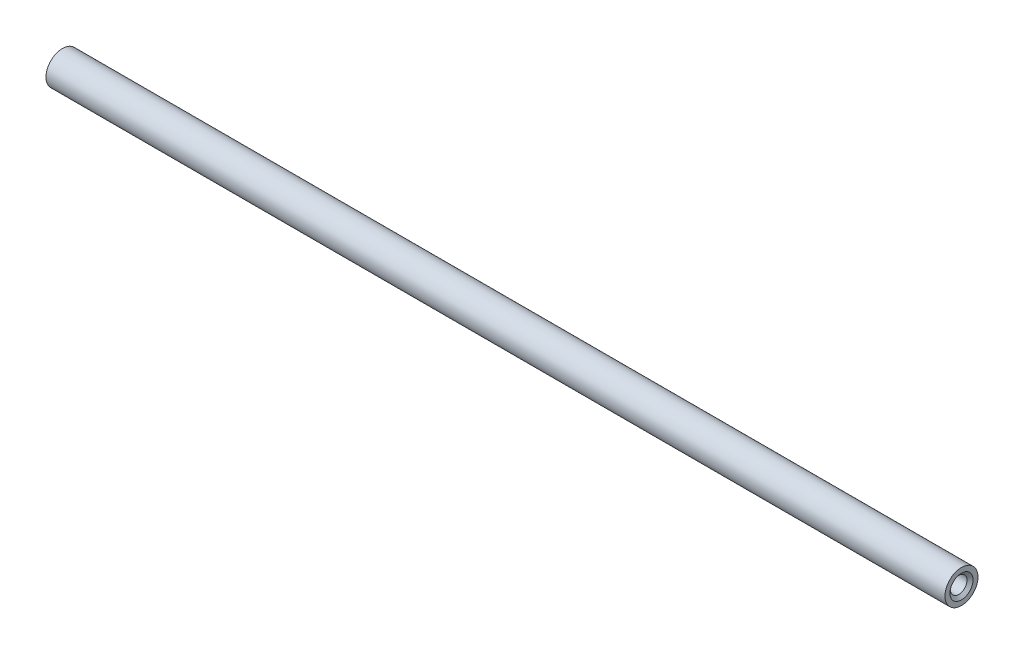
SolidWorks part; units mm, degrees
ref_plane "Front Plane" through (0, 0, 0) normal (0, 0, 1) x (1, 0, 0)
ref_plane "Top Plane" through (0, 0, 0) normal (0, 1, 0) x (1, 0, 0)
ref_plane "Right Plane" through (0, 0, 0) normal (1, 0, 0) x (0, 0, -1)
sketch "Sketch1" plane through (0, 0, 0) normal (0, 1, 0) x (1, 0, 0)
  line L13 (0, 0) -> (-172.72, 0)
  line L14 (0, 0) -> (0, 3.175)
  line L15 (0, 3.175) -> (-172.72, 3.175)
  line L16 (-172.72, 0) -> (-172.72, 3.175)
  dimension "D1" = 3.175
  dimension "D2" = 172.72
revolve "Revolve3" add sketch "Sketch1" angle 360 about L15
hole_wizard "1/8 (0.125) Diameter Hole1" positions "Sketch6" profile "Sketch8" hole size "1/8" standard "ANSI Inch"
sketch "Sketch6" plane through (-172.72, 0, 0) normal (-1, 0, 0) x (0, 0, 1)
  point P0 (-3.175, 0)
sketch "Sketch8" plane through (-172.72, 0, -3.175) normal (0, 1, 0) x (0, 0, 1)
  line L0 (0, 0) -> (0, 20.0039)
  line L1 (0, 20.0039) -> (1.5875, 19.05)
  line L2 (1.5875, 19.05) -> (1.5875, 0.5328)
  line L3 (1.5875, 0.5328) -> (2.2225, 0)
  line L5 (2.2225, 0) -> (0, 0)
  line L6 (-1.5875, 0.5328) -> (-2.2225, 0) construction
  line L10 (0, 20.0039) -> (-1.5875, 19.05) construction
  line L11 (0, -6.35) -> (0, 107.95) construction
  dimension "Hole Dia." = 3.175
  dimension "Hole Depth" = 19.05
  dimension "Near C'Sink Dia." = 4.445
  dimension "Near C'Sink Angle" = 100
  dimension "Drill Angle" = 118
hole_wizard "1/8 (0.125) Diameter Hole3" positions "Sketch11" profile "Sketch12" hole size "1/8" standard "ANSI Inch"
sketch "Sketch11" plane through (0, 0, 0) normal (1, 0, 0) x (0, 0, -1)
  point P0 (3.175, 0)
sketch "Sketch12" plane through (0, 0, -3.175) normal (0, 1, 0) x (0, 0, -1)
  line L0 (0, 0) -> (0, 20.0039)
  line L1 (0, 20.0039) -> (1.5875, 19.05)
  line L2 (1.5875, 19.05) -> (1.5875, 0.5328)
  line L3 (1.5875, 0.5328) -> (2.2225, 0)
  line L5 (2.2225, 0) -> (0, 0)
  line L6 (-1.5875, 0.5328) -> (-2.2225, 0) construction
  line L10 (0, 20.0039) -> (-1.5875, 19.05) construction
  line L11 (0, -6.35) -> (0, 107.95) construction
  dimension "Hole Dia." = 3.175
  dimension "Hole Depth" = 19.05
  dimension "Near C'Sink Dia." = 4.445
  dimension "Near C'Sink Angle" = 100
  dimension "Drill Angle" = 118
